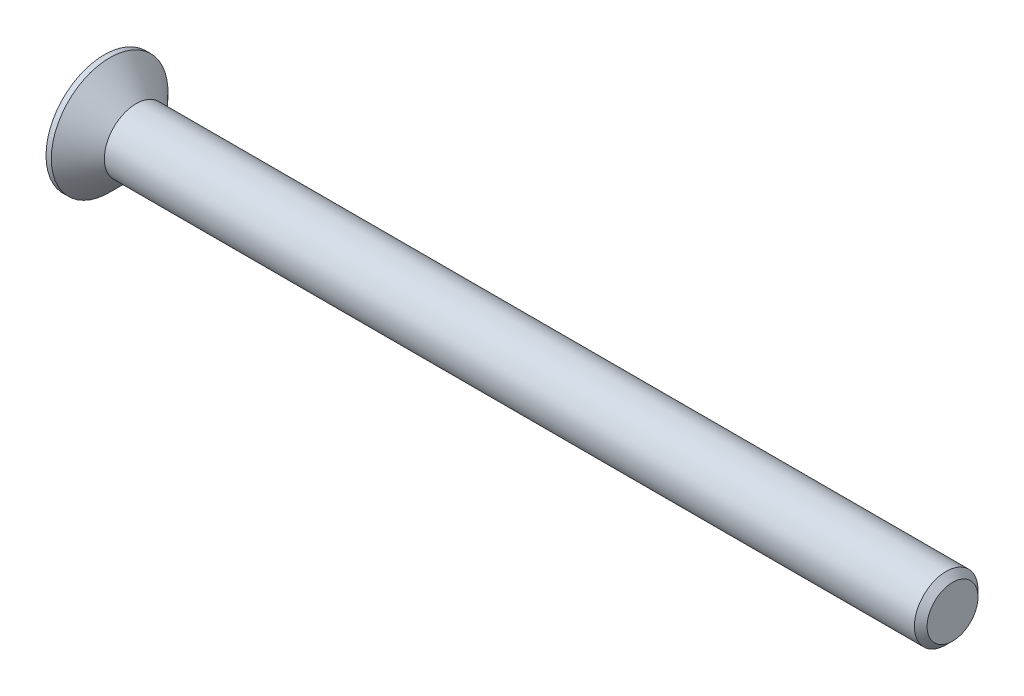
SolidWorks part; units mm, degrees
ref_plane "Front Plane" through (0, 0, 0) normal (0, 0, 1) x (1, 0, 0)
ref_plane "Top Plane" through (0, 0, 0) normal (0, 1, 0) x (1, 0, 0)
ref_plane "Right Plane" through (0, 0, 0) normal (1, 0, 0) x (0, 0, -1)
sketch "Sketch1" plane through (0, 0, 0) normal (0, 0, 1) x (1, 0, 0)
  line L1 (-3, 5.5) -> (-3, 0)
  line L2 (-3, 0) -> (77, 0)
  line L3 (77, 0) -> (77, 3)
  line L4 (77, 3) -> (0, 3)
  line L5 (-3, 5.5) -> (-2.5, 5.5)
  line L6 (-2.5, 5.5) -> (0, 3)
  dimension "D1" = 3
  dimension "D2" = 45
  dimension "D3" = 3
  dimension "D4" = 80
  dimension "D5" = 5.5
revolve "Revolve1" add sketch "Sketch1" angle 360 about L2
chamfer "Chamfer1" distance 0.6 angle 45 1 edges at (77, 0, 3)
sketch "Sketch2" plane through (-3, 0, 0) normal (-1, 0, 0) x (0, 0, 1)
  line L0 (-0.825, 3.3) -> (0.825, 3.3)
  line L1 (0.825, 3.3) -> (0.825, 0.825)
  line L2 (0.825, 0.825) -> (3.3, 0.825)
  line L3 (3.3, 0.825) -> (3.3, -0.825)
  line L4 (3.3, -0.825) -> (0.825, -0.825)
  line L5 (0.825, -0.825) -> (0.825, -3.3)
  line L6 (0.825, -3.3) -> (-0.825, -3.3)
  line L7 (-0.825, -3.3) -> (-0.825, -0.825)
  line L8 (-0.825, -0.825) -> (-3.3, -0.825)
  line L9 (-3.3, -0.825) -> (-3.3, 0.825)
  line L10 (-3.3, 0.825) -> (-0.825, 0.825)
  line L11 (-0.825, 0.825) -> (-0.825, 3.3)
  point P2 (0, 3.3)
  point P14 (0, -3.3)
  point P15 (3.3, 0)
  point P16 (-3.3, 0)
  dimension "D1" = 6.6
  dimension "D2" = 1.65
extrude "Cut-Extrude1" cut sketch "Sketch2" against normal blind 2.5
